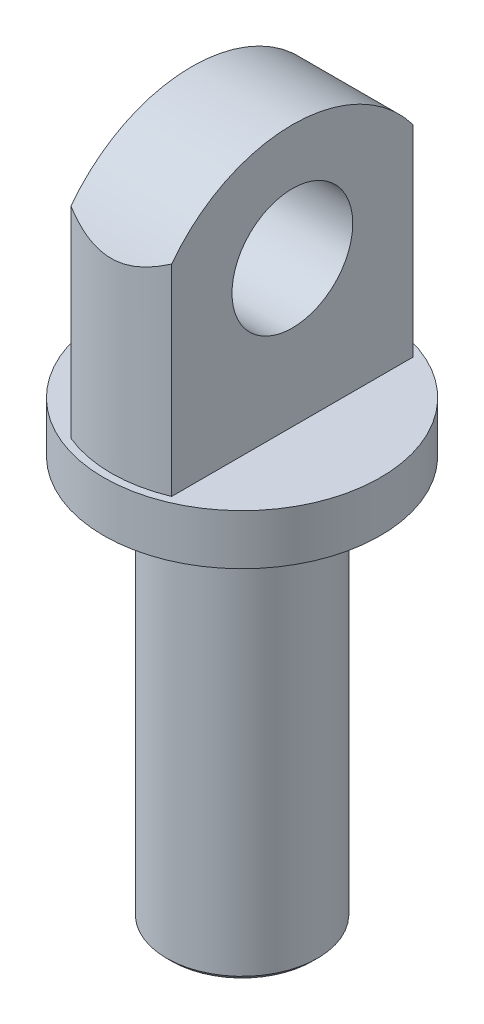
SolidWorks part; units mm, degrees
ref_plane "Plan de face" through (0, 0, 0) normal (0, 0, 1) x (1, 0, 0)
ref_plane "Plan de dessus" through (0, 0, 0) normal (0, 1, 0) x (1, 0, 0)
ref_plane "Plan de droite" through (0, 0, 0) normal (1, 0, 0) x (0, 0, -1)
sketch "Esquisse2" plane through (0, 0, 0) normal (0, 1, 0) x (1, 0, 0)
  circle A0 centre (0, 0) radius 15
  dimension "D1" = 30
extrude "Extrusion1" add sketch "Esquisse2" along normal blind 80
sketch "Esquisse3" plane through (0, 80, 0) normal (0, 1, 0) x (1, 0, 0)
  circle A0 centre (0, 0) radius 27.5
  dimension "D1" = 55
extrude "Extrusion2" add sketch "Esquisse3" along normal blind 10
sketch "Esquisse4" plane through (0, 90, 0) normal (0, 1, 0) x (1, 0, 0)
  line L0 (0, 28.9295) -> (0, -30.2867) construction
  line L1 (-10, 24) -> (-10, -24)
  line L2 (10, 24) -> (10, -24)
  arc A0 (-10, -24) -> (10, -24) centre (0, 0) ccw
  arc A1 (10, 24) -> (-10, 24) centre (0, 0) ccw
  dimension "D1" = 52
  dimension "D2" = 20
extrude "Extrusion3" add sketch "Esquisse4" along normal blind 52
sketch "Esquisse5" plane through (10, 0, 0) normal (1, 0, 0) x (0, 0, -1)
  line L0 (-27.5, 80) -> (27.5, 80) construction
  line L1 (0, -4.1642) -> (0, 151.1451) construction
  line L2 (-26, 142) -> (-26, 90) construction
  line L3 (26, 90) -> (26, 142) construction
  line L4 (-24, 142) -> (24, 142) construction
  line L5 (-59.3997, 126.9666) -> (72.6416, 126.9666) construction
  line L6 (-26, 126.9666) -> (-41.6176, 129.5796)
  line L7 (-41.6176, 129.5796) -> (-38.2613, 149.6399)
  line L8 (-38.2613, 149.6399) -> (33.6724, 149.6399)
  line L9 (33.6724, 149.6399) -> (39.5367, 135.0656)
  line L10 (39.5367, 135.0656) -> (26, 126.9666)
  circle A0 centre (0, 119) radius 12
  arc A1 (-26, 126.9666) -> (26, 126.9666) centre (0, 112) cw
  dimension "D2" = 24
  dimension "D3" = 30
  dimension "D1" = 39
extrude "Extrusion4" cut sketch "Esquisse5" against normal blind 52
chamfer "Chanfrein1" distance 1 angle 45 1 edges at (0, 0, 15)
